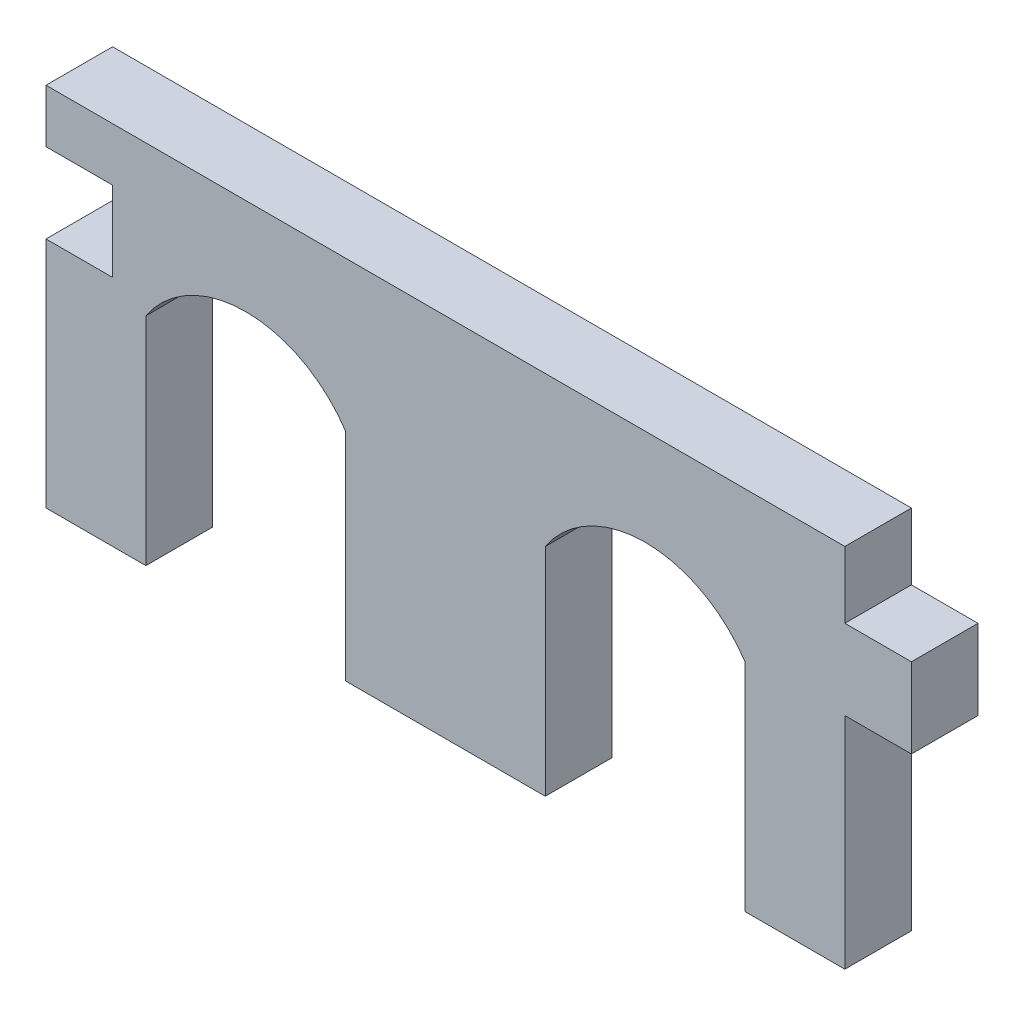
SolidWorks part; units mm, degrees
ref_plane "Front Plane" through (0, 0, 0) normal (0, 0, 1) x (1, 0, 0)
ref_plane "Top Plane" through (0, 0, 0) normal (0, 1, 0) x (1, 0, 0)
ref_plane "Right Plane" through (0, 0, 0) normal (1, 0, 0) x (0, 0, -1)
sketch "Sketch1" plane through (0, 0, 0) normal (0, 0, 1) x (1, 0, 0)
  line L0 (-38.1, 0) -> (-38.1, 28.575) construction
  line L1 (-76.2, 28.575) -> (0, 28.575)
  line L2 (-76.2, 28.575) -> (-76.2, 0)
  line L3 (-76.2, 0) -> (0, 0)
  line L4 (0, 28.575) -> (0, 0)
  line L5 (-76.2, 0) -> (-66.675, 0)
  line L6 (-66.675, 0) -> (-47.625, 0)
  line L7 (-66.675, 0) -> (-66.675, 14.2875)
  line L8 (-66.675, 14.2875) -> (-47.625, 14.2875)
  line L9 (-47.625, 0) -> (-47.625, 14.2875)
  line L10 (-28.575, 0) -> (-9.525, 0)
  line L11 (-28.575, 0) -> (-28.575, 14.2875)
  line L12 (-28.575, 14.2875) -> (-9.525, 14.2875)
  line L13 (-9.525, 0) -> (-9.525, 14.2875)
  line L26 (0, 22.225) -> (6.35, 22.225)
  line L27 (0, 22.225) -> (0, 14.605)
  line L28 (0, 14.605) -> (6.35, 14.605)
  line L29 (6.35, 22.225) -> (6.35, 14.605)
  line L30 (-76.2, 0) -> (-76.2, -6.35)
  line L31 (-66.675, 0) -> (-66.675, -6.35)
  line L32 (-76.2, -6.35) -> (-66.675, -6.35)
  line L33 (-47.625, 0) -> (-28.575, 0)
  line L34 (-47.625, 0) -> (-47.625, -6.35)
  line L35 (-28.575, 0) -> (-28.575, -6.35)
  line L36 (-47.625, -6.35) -> (-28.575, -6.35)
  line L37 (-9.525, 0) -> (0, 0)
  line L38 (-9.525, 0) -> (-9.525, -6.35)
  line L39 (0, 0) -> (0, -6.35)
  line L40 (-9.525, -6.35) -> (0, -6.35)
  line L42 (-76.2, 23.495) -> (-69.85, 23.495)
  line L43 (-76.2, 23.495) -> (-76.2, 15.875)
  line L44 (-76.2, 15.875) -> (-69.85, 15.875)
  line L45 (-69.85, 23.495) -> (-69.85, 15.875)
  arc A0 (-66.675, 14.2875) -> (-47.625, 14.2875) centre (-57.15, 7.9693) cw
  arc A1 (-28.575, 14.2875) -> (-9.525, 14.2875) centre (-19.05, 7.9693) cw
  dimension "D9" = 11.43
  dimension "D10" = 11.43
  dimension "D1" = 28.575
  dimension "D2" = 76.2
  dimension "D3" = 9.525
  dimension "D4" = 19.05
  dimension "D5" = 14.2875
  dimension "D6" = 14.2875
  dimension "D7" = 19.05
  dimension "D8" = 9.525
  dimension "D17" = 6.35
  dimension "D18" = 7.62
  dimension "D19" = 5.08
  dimension "D20" = 6.35
  dimension "D21" = 7.62
  dimension "D22" = 6.35
  dimension "D23" = 6.35
  dimension "D24" = 6.35
  dimension "D25" = 6.35
extrude "Boss-Extrude4" add sketch "Sketch1" along normal blind 6.35
